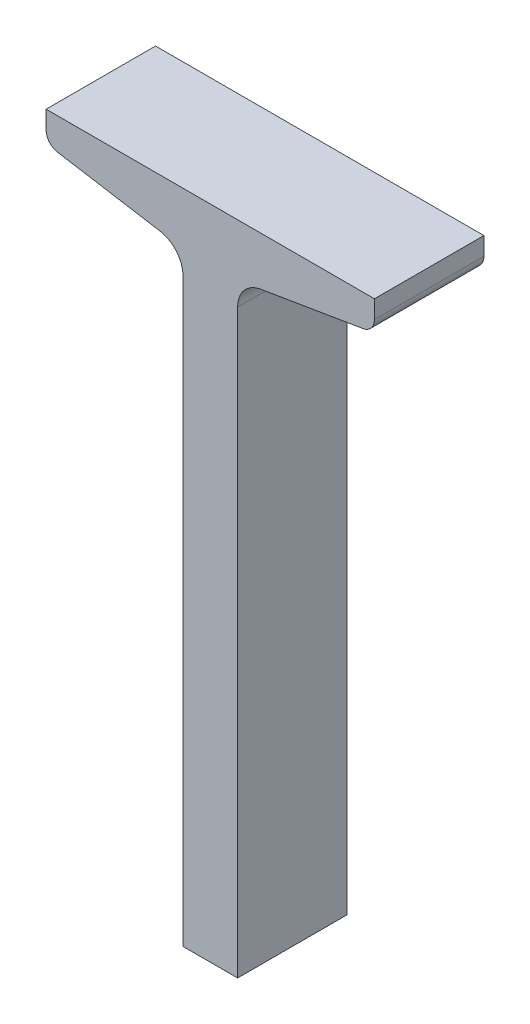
SolidWorks part; units mm, degrees
ref_plane "Plane1" through (0, 0, 0) normal (0, 0, 1) x (1, 0, 0)
ref_plane "Plane2" through (0, 0, 0) normal (0, 1, 0) x (-1, 0, 0)
ref_plane "Plane3" through (0, 0, 0) normal (1, 0, 0) x (0, 0, -1)
sketch "Sketch1" plane through (0, 0, 0) normal (0, 0, 1) x (1, 0, 0)
  line L0 (0, 0) -> (76.2, 0)
  line L1 (15.6984, 0) -> (-15.6984, 0) construction
  line L2 (31.75, -152.4) -> (31.75, -17.5502)
  line L3 (26.444, -11.2866) -> (0, -6.879)
  line L4 (0, -9.8115) -> (0, 9.8115) construction
  line L5 (0, 0) -> (0, -6.879)
  line L6 (76.2, 0) -> (76.2, -6.879)
  line L7 (76.2, -6.879) -> (49.756, -11.2866)
  line L8 (44.45, -17.5502) -> (44.45, -152.4)
  line L9 (31.75, -9.525) -> (-6.2843, -9.525) construction
  line L12 (31.75, -152.4) -> (44.45, -152.4)
  arc A1 (31.75, -17.5502) -> (26.444, -11.2866) centre (25.4, -17.5502) ccw
  arc A2 (49.756, -11.2866) -> (44.45, -17.5502) centre (50.8, -17.5502) ccw
  dimension "RI" = 6.35
  dimension "D2" = 9.463
  dimension "D1" = 134.8498
  dimension "TW" = 12.7
  dimension "BF" = 76.2
  dimension "DEPTH" = 152.4
  dimension "TF" = 9.525
  dimension "delta" = 31.75
extrude "BaseStee" add sketch "Sketch1" along normal mid plane 25.4
fillet "ToeFillet" radius 3.175 2 edges at (0, -6.879, 0) (76.2, -6.879, 0)
equation "\"delta@Sketch1\" =  (  ( \"BF@Sketch1\" / 2  ) -  ( \"TW@Sketch1\" / 2  ) ) "
equation "\"d1@Sketch1\" = \"Depth@Sketch1\" - \"TF@Sketch1\" -  ( \"RI@Sketch1\" * cos(\"D2@Sketch1\"/180*3.141592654))-((((\"BF@Sketch1\"/2-\"TW@Sketch1\"/2)/2)-(\"RI@Sketch1\"-\"RI@Sketch1\"*sin(\"D2@Sketch1\"/180*3.141592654))"
